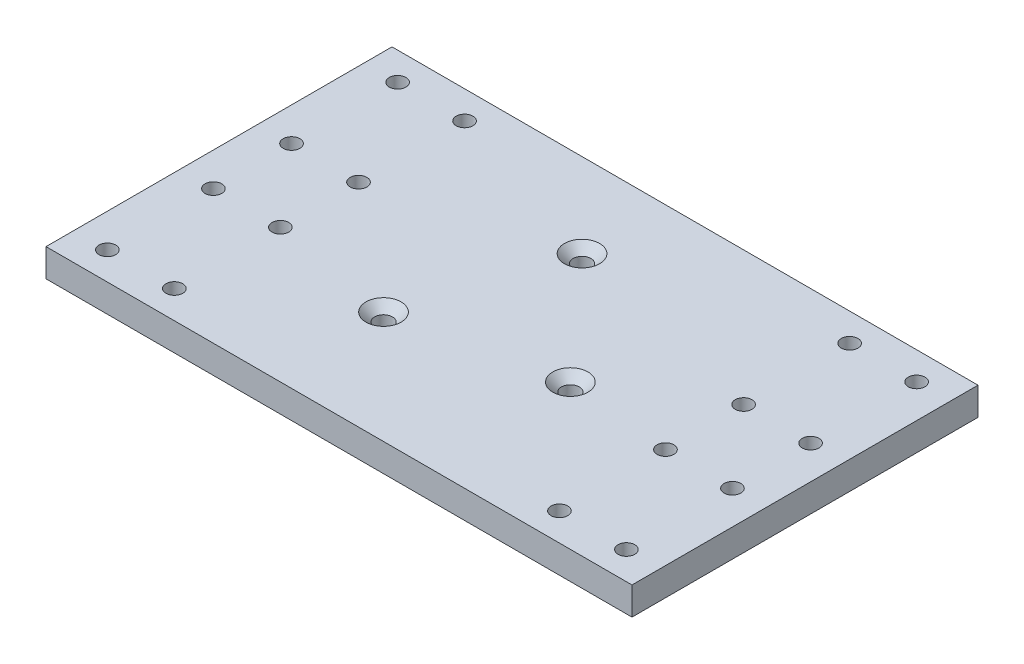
SolidWorks part; units mm, degrees
ref_plane "Front Plane" through (0, 0, 0) normal (0, 0, 1) x (1, 0, 0)
ref_plane "Top Plane" through (0, 0, 0) normal (0, 1, 0) x (1, 0, 0)
ref_plane "Right Plane" through (0, 0, 0) normal (1, 0, 0) x (0, 0, -1)
sketch "Sketch1" plane through (0, 0, 0) normal (0, 1, 0) x (1, 0, 0)
  line L0 (-52.5, -31) -> (52.5, -31)
  line L1 (-52.5, -31) -> (-52.5, 31)
  line L2 (52.5, -31) -> (52.5, 31)
  line L3 (-52.5, 31) -> (52.5, 31)
  line L4 (-52.5, -31) -> (52.5, 31) construction
  line L5 (52.5, -31) -> (-52.5, 31) construction
  line L6 (0, 31) -> (0, -31) construction
  line L7 (52.5, 0) -> (-52.5, 0) construction
  circle A4 centre (46.5, -26) radius 1.5
  circle A5 centre (34.5, -26) radius 1.5
  circle A6 centre (34.5, -7) radius 1.5
  circle A7 centre (46.5, -7) radius 1.5
  circle A8 centre (-34.5, -26) radius 1.5
  circle A9 centre (-46.5, -26) radius 1.5
  circle A10 centre (-46.5, -7) radius 1.5
  circle A11 centre (-34.5, -7) radius 1.5
  circle A12 centre (34.5, 26) radius 1.5
  circle A13 centre (46.5, 26) radius 1.5
  circle A14 centre (46.5, 7) radius 1.5
  circle A15 centre (34.5, 7) radius 1.5
  circle A16 centre (-34.5, 26) radius 1.5
  circle A17 centre (-46.5, 26) radius 1.5
  circle A18 centre (-46.5, 7) radius 1.5
  circle A19 centre (-34.5, 7) radius 1.5
  point P1 (0, 0)
  dimension "D3" = 5
  dimension "D4" = 3
  dimension "D5" = 6
  dimension "D6" = 6
  dimension "D8" = 3
  dimension "D11" = 3
  dimension "D14" = 3
  dimension "D1" = 105
  dimension "D2" = 62
  dimension "D7" = 24
  dimension "D9" = 24
  dimension "D10" = 18
  dimension "D12" = 18
  dimension "D13" = 5
extrude "Boss-Extrude1" add sketch "Sketch1" along normal blind 5
sketch "Sketch4" plane through (0, 5, 0) normal (0, 1, 0) x (1, 0, 0)
  line L7 (52.5, 31) -> (-52.5, 31) construction
  line L8 (-52.5, 31) -> (-52.5, -31) construction
  line L9 (52.5, -31) -> (52.5, 31) construction
  circle A3 centre (-3.39, 15.94) radius 1.5
  circle A4 centre (-12.11, -10.91) radius 1.5
  circle A5 centre (15.5, -5.04) radius 1.5
  dimension "D1" = 15.06
  dimension "D3" = 3
  dimension "D4" = 3
  dimension "D6" = 40.39
  dimension "D7" = 3
  dimension "D2" = 49.11
  dimension "D5" = 41.91
  dimension "D8" = 36.04
  dimension "D9" = 37
extrude "Cut-Extrude1" cut sketch "Sketch4" against normal through all
sketch "Sketch5" plane through (0, 5, 0) normal (0, 1, 0) x (1, 0, 0)
  circle A0 centre (-12.11, -10.91) radius 1.5
  circle A1 centre (-3.39, 15.94) radius 1.5
  circle A2 centre (15.5, -5.04) radius 1.5
  point P0 (-12.11, -10.91)
  point P3 (-3.39, 15.94)
  point P6 (15.5, -5.04)
  dimension "D1" = 3
  dimension "D2" = 3
  dimension "D3" = 3
hole_wizard "CSK for M3 Flat Head Machine Screw1" positions "Sketch5" profile "Sketch6" countersink size "M3" standard "ANSI Metric"
sketch "Sketch6" plane through (-12.11, 5, 10.91) normal (1, 0, 0) x (0, 0, 1)
  line L0 (0, 0) -> (0, 6.35)
  line L1 (0, 6.35) -> (1.6, 5.3886)
  line L2 (1.6, 5.3886) -> (1.6, 1.55)
  line L3 (1.6, 1.55) -> (3.15, 0)
  line L5 (3.15, 0) -> (0, 0)
  line L6 (-1.6, 1.55) -> (-3.15, 0) construction
  line L10 (0, 6.35) -> (-1.6, 5.3886) construction
  line L11 (0, -6.35) -> (0, 107.95) construction
  dimension "Hole Dia." = 3.2
  dimension "Hole Depth" = 6.35
  dimension "Near C'Sink Dia." = 6.3
  dimension "Near C'Sink Angle" = 90
  dimension "Drill Angle" = 118
